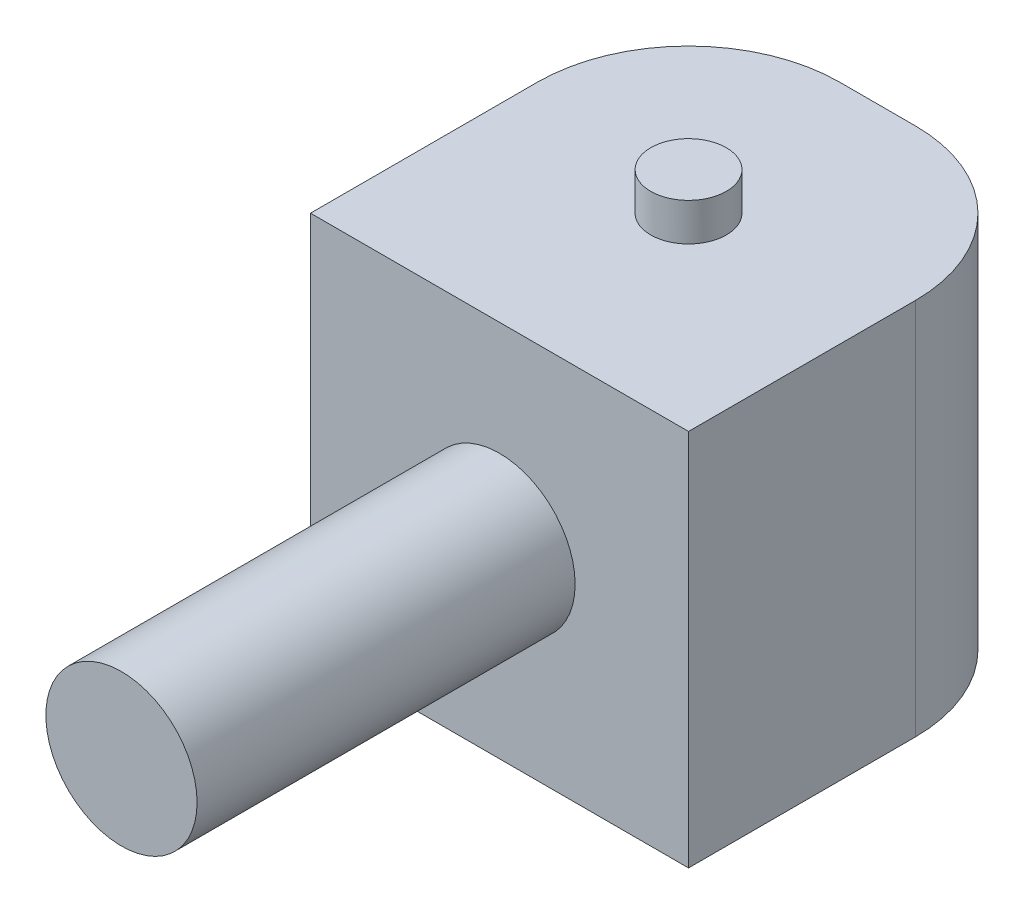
SolidWorks part; units mm, degrees
ref_plane "Front Plane" through (0, 0, 0) normal (0, 0, 1) x (1, 0, 0)
ref_plane "Top Plane" through (0, 0, 0) normal (0, 1, 0) x (1, 0, 0)
ref_plane "Right Plane" through (0, 0, 0) normal (1, 0, 0) x (0, 0, -1)
sketch "Sketch1" plane through (0, 0, 0) normal (0, 0, 1) x (1, 0, 0)
  line L0 (1.27, -1.27) -> (-1.27, -1.27)
  line L1 (1.27, -1.27) -> (1.27, 1.27)
  line L2 (1.27, 1.27) -> (-1.27, 1.27)
  line L3 (-1.27, -1.27) -> (-1.27, 1.27)
  line L4 (0, 1.27) -> (0, -1.27) construction
  line L5 (-1.27, 0) -> (1.27, 0) construction
  dimension "D1" = 2.54
extrude "Boss-Extrude1" add sketch "Sketch1" against normal blind 2.54
sketch "Sketch3" plane through (0, 0, 0) normal (0, 0, 1) x (1, 0, 0)
  circle A0 centre (0, 0) radius 0.508
extrude "Boss-Extrude2" add sketch "Sketch3" along normal blind 2.54
sketch "Sketch4" plane through (0, -1.27, 0) normal (0, -1, 0) x (1, 0, 0)
  circle A0 centre (0, -1.27) radius 0.254
extrude "Boss-Extrude3" add sketch "Sketch4" along normal blind 0.254
mirror "Mirror1" about plane through (0, 0, 0) normal (0, 1, 0) of "Boss-Extrude3"
sketch "Sketch6" plane through (0, 0, 0) normal (0, 1, 0) x (1, 0, 0)
  line L0 (1.27, 2.54) -> (-1.27, 2.54) construction
  line L1 (0, 2.54) -> (0, 2.7178)
  line L2 (0, 2.54) -> (0.1778, 2.54)
  arc A0 (0.1778, 2.54) -> (0, 2.7178) centre (0, 2.54) ccw
revolve "Revolve1" add sketch "Sketch6" angle 360 about L1
fillet "Fillet1" radius 1.016 2 edges at (1.27, 0, -2.54) (-1.27, 0, -2.54)
